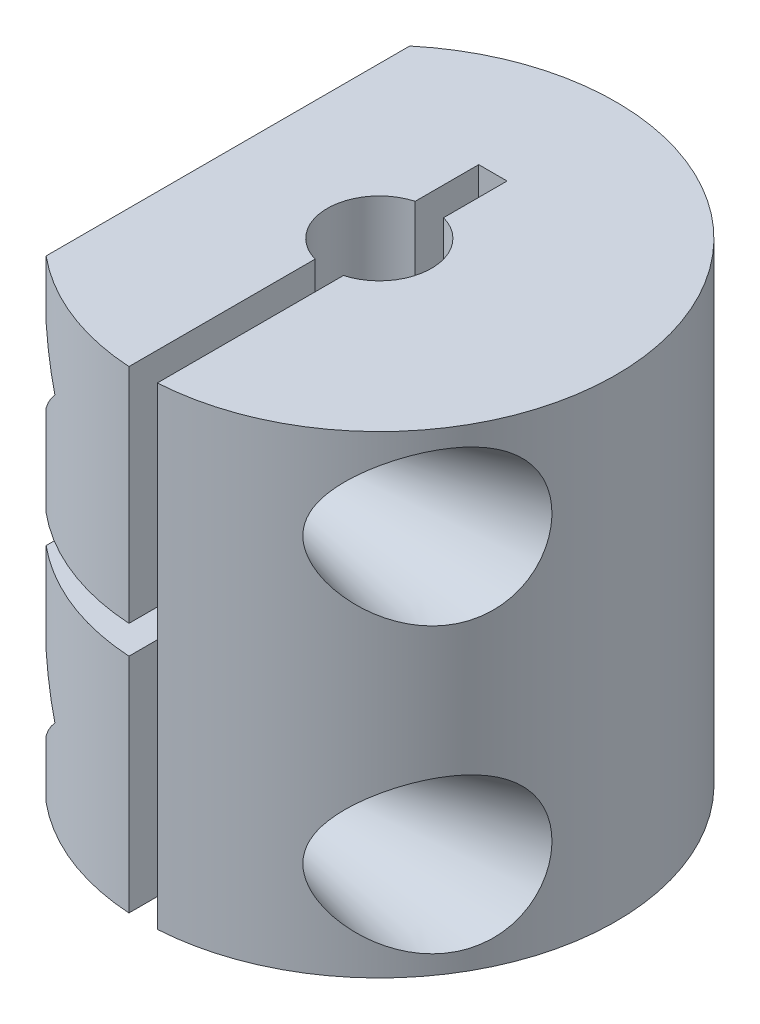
SolidWorks part; units mm, degrees
ref_plane "Front Plane" through (0, 0, 0) normal (0, 0, 1) x (1, 0, 0)
ref_plane "Top Plane" through (0, 0, 0) normal (0, 1, 0) x (1, 0, 0)
ref_plane "Right Plane" through (0, 0, 0) normal (1, 0, 0) x (0, 0, -1)
sketch "Sketch1" plane through (0, 0, 0) normal (0, 1, 0) x (1, 0, 0)
  circle A0 centre (0, 0) radius 12.5
  dimension "D1" = 25
extrude "Boss-Extrude1" add sketch "Sketch1" along normal blind 25
sketch "Sketch2" plane through (0, 25, 0) normal (0, 1, 0) x (1, 0, 0)
  circle A0 centre (0, 0) radius 2.75
  dimension "D1" = 5.5
extrude "Cut-Extrude1" cut sketch "Sketch2" against normal through all
sketch "Sketch3" plane through (0, 25, 0) normal (0, 1, 0) x (1, 0, 0)
  line L1 (-0.75, 6) -> (0.75, 6)
  line L2 (-0.75, 6) -> (-0.75, -13)
  line L3 (-0.75, -13) -> (0.75, -13)
  line L4 (0.75, 6) -> (0.75, -13)
  point P4 (0, 6)
  dimension "D1" = 19
  dimension "D2" = 1.5
  dimension "D3" = 6
extrude "Cut-Extrude2" cut sketch "Sketch3" against normal through all
sketch "Sketch4" plane through (0.75, 0, 0) normal (-1, 0, 0) x (0, 0, 1)
  line L0 (12.4775, 25) -> (2.6458, 25) construction
  circle A0 centre (7.5616, 20) radius 1.5
  circle A1 centre (7.5616, 5) radius 1.5
  point P6 (7.5616, 25)
  dimension "D1" = 3
  dimension "D2" = 15
  dimension "D3" = 5
extrude "Cut-Extrude3" cut sketch "Sketch4" against normal blind 15 draft 15 and the other way through all
sketch "Sketch11" plane through (0.75, 0, 0) normal (-1, 0, 0) x (0, 0, 1)
  line L0 (-6, 0) -> (-6, 25) construction
  line L1 (-6, 11.75) -> (12.4775, 11.75)
  line L2 (-6, 11.75) -> (-6, 13.25)
  line L3 (-6, 13.25) -> (12.4775, 13.25)
  line L4 (12.4775, 11.75) -> (12.4775, 13.25)
  line L5 (12.4775, 25) -> (12.4775, 0) construction
  point P8 (12.4775, 12.5)
  point P9 (12.4775, 12.5)
  dimension "D1" = 1.5
extrude "Cut-Extrude4" cut sketch "Sketch11" along normal through all
sketch "Sketch12" plane through (0, 25, 0) normal (0, 1, 0) x (1, 0, 0)
  line L0 (-8, 9.6047) -> (-8, -9.6047)
  line L6 (-0.75, -12.4775) -> (-0.75, -2.6458)
  line L7 (-0.75, 2.6458) -> (-0.75, 6)
  line L8 (-0.75, 6) -> (0.75, 6)
  line L9 (0.75, 6) -> (0.75, -2.6458)
  line L15 (0.75, 2.6458) -> (0.75, -12.4775)
  arc A0 (0.75, -12.4775) -> (-0.75, -12.4775) centre (0, 0) ccw construction
  arc A3 (-0.75, 2.6458) -> (-0.75, -2.6458) centre (0, 0) ccw
  arc A4 (0.75, 2.6458) -> (0.75, -2.6458) centre (0, 0) ccw
  arc A5 (0.75, -12.4775) -> (-0.75, -12.4775) centre (0, 0) ccw
  arc A8 (-8, 9.6047) -> (-8, -9.6047) centre (0, 0) ccw
  dimension "D2" = 8
  dimension "D1" = 0
extrude "Cut-Extrude5" cut sketch "Sketch12" against normal through all
sketch "Sketch14" plane through (-8, 0, 0) normal (-1, 0, 0) x (0, 0, 1)
  line L0 (-12.5, 12.5) -> (12.4775, 12.5) construction
  line L7 (4.3862, 20) -> (5.9739, 17.25)
  line L8 (5.9739, 17.25) -> (9.1493, 17.25)
  line L9 (9.1493, 17.25) -> (10.737, 20)
  line L10 (10.737, 20) -> (9.1493, 22.75)
  line L11 (9.1493, 22.75) -> (5.9739, 22.75)
  line L12 (5.9739, 22.75) -> (4.3862, 20)
  line L13 (-12.5, 25) -> (-12.5, 0) construction
  line L14 (12.4775, 25) -> (12.4775, 0) construction
  line L15 (5.9739, 2.25) -> (4.3862, 5)
  line L16 (9.1493, 2.25) -> (5.9739, 2.25)
  line L17 (10.737, 5) -> (9.1493, 2.25)
  line L18 (9.1493, 7.75) -> (10.737, 5)
  line L19 (5.9739, 7.75) -> (9.1493, 7.75)
  line L20 (4.3862, 5) -> (5.9739, 7.75)
  circle A0 centre (7.5616, 20) radius 2.75 construction
  point P10 (7.5616, 22.75)
  dimension "D1" = 5.5
extrude "Cut-Extrude6" cut sketch "Sketch14" against normal blind 3
